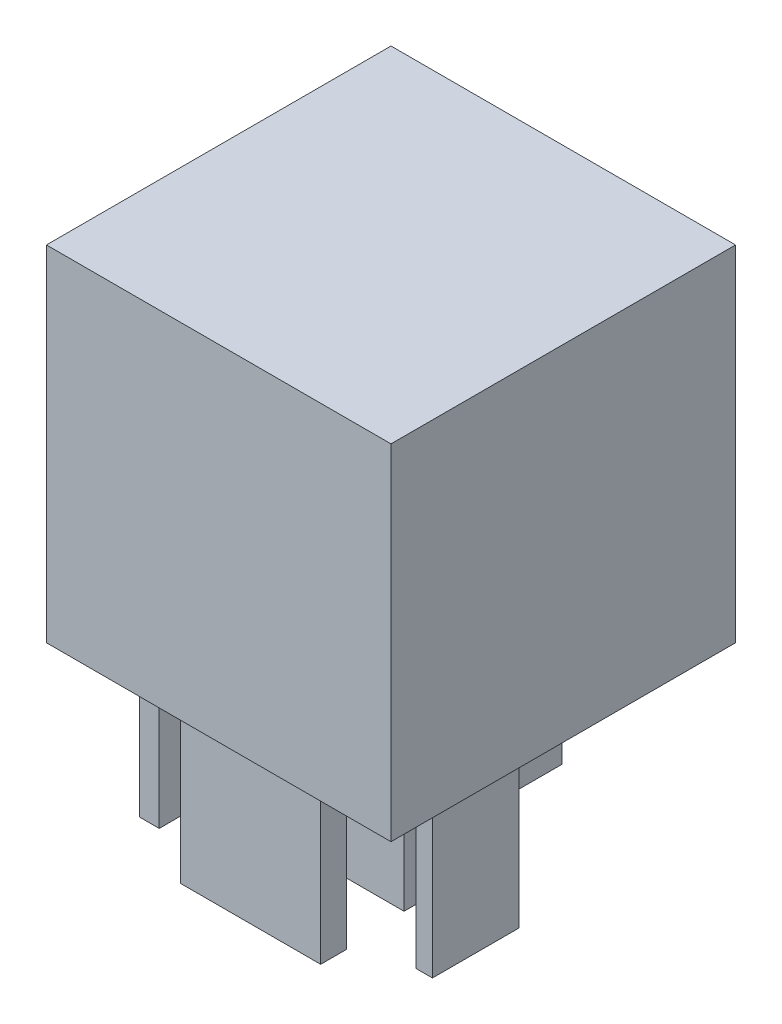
SolidWorks part; units mm, degrees
ref_plane "Plan de face" through (0, 0, 0) normal (0, 0, 1) x (1, 0, 0)
ref_plane "Plan de dessus" through (0, 0, 0) normal (0, 1, 0) x (1, 0, 0)
ref_plane "Plan de droite" through (0, 0, 0) normal (1, 0, 0) x (0, 0, -1)
sketch "Esquisse1" plane through (0, 0, 0) normal (0, 0, 1) x (1, 0, 0)
  line L1 (-20, 0) -> (20, 0)
  line L2 (-20, 0) -> (-20, 40)
  line L3 (-20, 40) -> (20, 40)
  line L4 (20, 0) -> (20, 40)
  dimension "D1" = 40
  dimension "D2" = 40
extrude "Boss.-Extru.1" add sketch "Esquisse1" along normal mid plane 40
sketch "Esquisse2" plane through (0, 0, 0) normal (0, -1, 0) x (1, 0, 0)
  line L1 (-8.026, 16.4094) -> (8.2459, 16.4094)
  line L2 (-8.026, 16.4094) -> (-8.026, 13.4409)
  line L3 (-8.026, 13.4409) -> (8.2459, 13.4409)
  line L4 (8.2459, 16.4094) -> (8.2459, 13.4409)
  line L5 (-8.2459, 6.2394) -> (7.7512, 6.2394)
  line L6 (-8.2459, 6.2394) -> (-8.2459, 2.6112)
  line L7 (-8.2459, 2.6112) -> (7.7512, 2.6112)
  line L8 (7.7512, 6.2394) -> (7.7512, 2.6112)
  line L9 (-1.6492, -3.3808) -> (2.1439, -3.3808)
  line L10 (-1.6492, -3.3808) -> (-1.6492, -17.7287)
  line L11 (-1.6492, -17.7287) -> (2.1439, -17.7287)
  line L12 (2.1439, -3.3808) -> (2.1439, -17.7287)
  line L13 (14.183, 11.2969) -> (16.107, 11.2969)
  line L14 (14.183, 11.2969) -> (14.183, 1.2369)
  line L15 (14.183, 1.2369) -> (16.107, 1.2369)
  line L16 (16.107, 11.2969) -> (16.107, 1.2369)
  line L17 (-17.0965, 12.1215) -> (-14.7877, 12.1215)
  line L18 (-17.0965, 12.1215) -> (-17.0965, 0.6872)
  line L19 (-17.0965, 0.6872) -> (-14.7877, 0.6872)
  line L20 (-14.7877, 12.1215) -> (-14.7877, 0.6872)
extrude "Boss.-Extru.2" add sketch "Esquisse2" along normal blind 20
